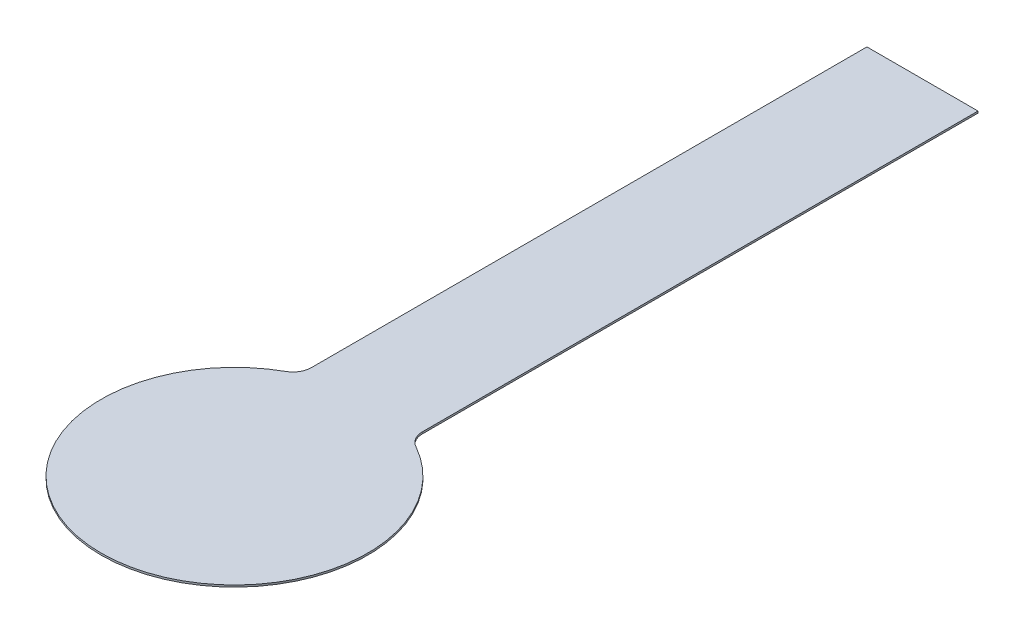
SolidWorks part; units mm, degrees
ref_plane "Front" through (0, 0, 0) normal (0, 0, 1) x (1, 0, 0)
ref_plane "Top" through (0, 0, 0) normal (0, 1, 0) x (1, 0, 0)
ref_plane "Right" through (0, 0, 0) normal (1, 0, 0) x (0, 0, -1)
sketch "Sketch2" plane through (0, 0, 0) normal (0, 1, 0) x (1, 0, 0)
  line L0 (-3.8097, 47.1911) -> (3.8097, 47.1911)
  line L1 (-3.8097, 9.0911) -> (-3.8097, 47.1911)
  line L2 (3.8097, 9.0911) -> (3.8097, 47.1911)
  arc A0 (-4.4602, 7.9824) -> (4.4602, 7.9824) centre (0, 0) ccw
  arc A1 (-4.4602, 7.9824) -> (-3.8097, 9.0911) centre (-5.0797, 9.0911) ccw
  arc A2 (3.8097, 9.0911) -> (4.4602, 7.9824) centre (5.0797, 9.0911) ccw
extrude "Extrude8" add sketch "Sketch2" along normal blind 0.127
